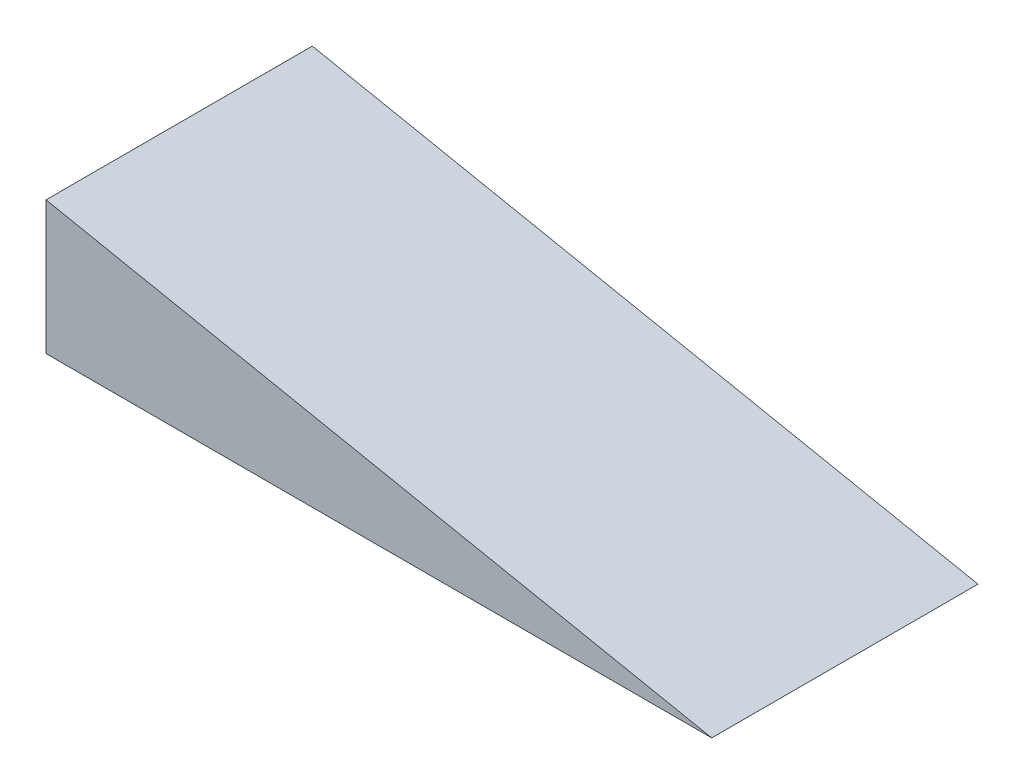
SolidWorks part; units mm, degrees
ref_plane "Front Plane" through (0, 0, 0) normal (0, 0, 1) x (1, 0, 0)
ref_plane "Top Plane" through (0, 0, 0) normal (0, 1, 0) x (1, 0, 0)
ref_plane "Right Plane" through (0, 0, 0) normal (1, 0, 0) x (0, 0, -1)
sketch "Sketch2" plane through (0, 0, 0) normal (0, 0, 1) x (1, 0, 0)
  line L0 (0, 0) -> (10, 0)
  line L1 (55, 0) -> (-55, 0) construction
  line L2 (0, 0) -> (0, 2)
  line L3 (0, -55) -> (0, 55) construction
  line L4 (0, 2) -> (10, 0)
  dimension "D1" = 10
  dimension "D2" = 2
extrude "Boss-Extrude2" add sketch "Sketch2" along normal blind 4
